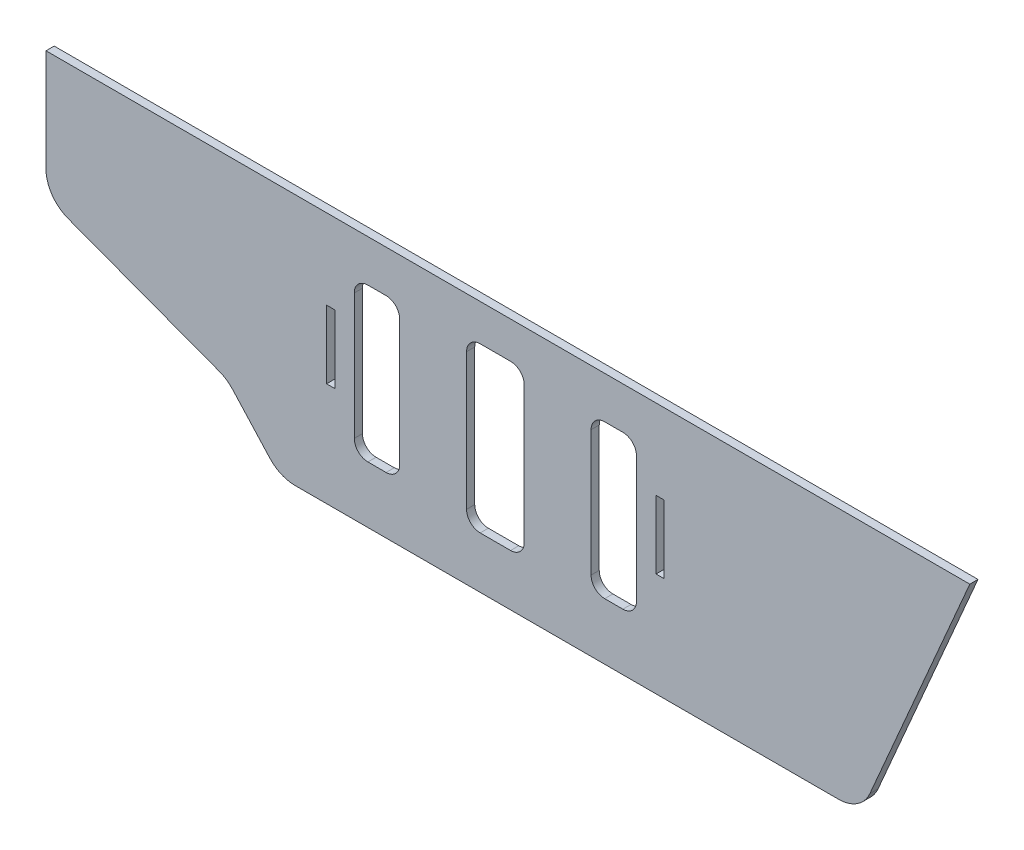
SolidWorks part; units mm, degrees
ref_plane "Front Plane" through (0, 0, 0) normal (0, 0, 1) x (1, 0, 0)
ref_plane "Top Plane" through (0, 0, 0) normal (0, 1, 0) x (1, 0, 0)
ref_plane "Right Plane" through (0, 0, 0) normal (1, 0, 0) x (0, 0, -1)
sketch "Sketch1" plane through (0, 0, 0) normal (0, 0, 1) x (1, 0, 0)
  line L1 (-115.2353, 38.553) -> (56.9686, 38.553)
  line L2 (-115.2353, 38.553) -> (-115.2353, 19.4699)
  line L3 (-68.824, -8.4142) -> (32.5064, -8.4142)
  line L4 (-61.4089, -3.9688) -> (-1.524, -3.9688) construction
  line L5 (-111.115, 13.5243) -> (-82.9263, 2.9531)
  line L6 (-62.9329, 10.9421) -> (-61.4089, 10.9421)
  line L7 (-62.9329, 10.9421) -> (-62.9329, 23.6421)
  line L8 (-62.9329, 23.6421) -> (-61.4089, 23.6421)
  line L9 (-61.4089, 10.9421) -> (-61.4089, 23.6421)
  line L10 (-1.524, 10.9421) -> (0, 10.9421)
  line L11 (-1.524, 10.9421) -> (-1.524, 23.6421)
  line L12 (-1.524, 23.6421) -> (0, 23.6421)
  line L13 (0, 10.9421) -> (0, 23.6421)
  line L14 (-80.4612, 1.2831) -> (-73.5188, -6.3398)
  line L15 (56.9686, 38.553) -> (38.3358, -4.5823)
  line L16 (-55.2338, 30.7245) -> (-51.8404, 30.7245)
  line L17 (-57.7738, 28.1845) -> (-57.7738, 4.7172)
  line L18 (-55.2338, 2.1772) -> (-51.8404, 2.1772)
  line L19 (-49.3004, 28.1845) -> (-49.3004, 4.7172)
  line L20 (-31.4665, -3.9688) -> (-31.4665, -33.268) construction
  line L21 (-13.6326, 28.1845) -> (-13.6326, 4.7172)
  line L22 (-7.6992, 2.1772) -> (-11.0926, 2.1772)
  line L23 (-5.1592, 28.1845) -> (-5.1592, 4.7172)
  line L24 (-7.6992, 30.7245) -> (-11.0926, 30.7245)
  line L26 (-34.3028, 1.1858) -> (-28.6301, 1.1858)
  line L27 (-36.8428, 3.7258) -> (-36.8428, 29.176)
  line L28 (-34.3028, 31.716) -> (-28.6301, 31.716)
  line L29 (-26.0901, 3.7258) -> (-26.0901, 29.176)
  line L30 (-36.8428, 1.1858) -> (-26.0901, 31.716) construction
  line L31 (-36.8428, 31.716) -> (-26.0901, 1.1858) construction
  arc A0 (38.3358, -4.5823) -> (32.5064, -8.4142) centre (32.5064, -2.0642) cw
  arc A1 (-82.9263, 2.9531) -> (-80.4612, 1.2831) centre (-85.156, -2.9925) cw
  arc A2 (-73.5188, -6.3398) -> (-68.824, -8.4142) centre (-68.824, -2.0642) ccw
  arc A3 (-111.115, 13.5243) -> (-115.2353, 19.4699) centre (-108.8853, 19.4699) cw
  arc A4 (-55.2338, 30.7245) -> (-57.7738, 28.1845) centre (-55.2338, 28.1845) ccw
  arc A5 (-51.8404, 30.7245) -> (-49.3004, 28.1845) centre (-51.8404, 28.1845) cw
  arc A6 (-51.8404, 2.1772) -> (-49.3004, 4.7172) centre (-51.8404, 4.7172) ccw
  arc A7 (-57.7738, 4.7172) -> (-55.2338, 2.1772) centre (-55.2338, 4.7172) ccw
  arc A8 (-5.1592, 4.7172) -> (-7.6992, 2.1772) centre (-7.6992, 4.7172) cw
  arc A9 (-11.0926, 2.1772) -> (-13.6326, 4.7172) centre (-11.0926, 4.7172) cw
  arc A10 (-11.0926, 30.7245) -> (-13.6326, 28.1845) centre (-11.0926, 28.1845) ccw
  arc A11 (-7.6992, 30.7245) -> (-5.1592, 28.1845) centre (-7.6992, 28.1845) cw
  arc A12 (-34.3028, 1.1858) -> (-36.8428, 3.7258) centre (-34.3028, 3.7258) cw
  arc A13 (-28.6301, 1.1858) -> (-26.0901, 3.7258) centre (-28.6301, 3.7258) ccw
  arc A14 (-28.6301, 31.716) -> (-26.0901, 29.176) centre (-28.6301, 29.176) cw
  arc A15 (-36.8428, 29.176) -> (-34.3028, 31.716) centre (-34.3028, 29.176) cw
  point P58 (-31.4665, 16.4509)
extrude "Boss-Extrude1" add sketch "Sketch1" along normal blind 1.524
